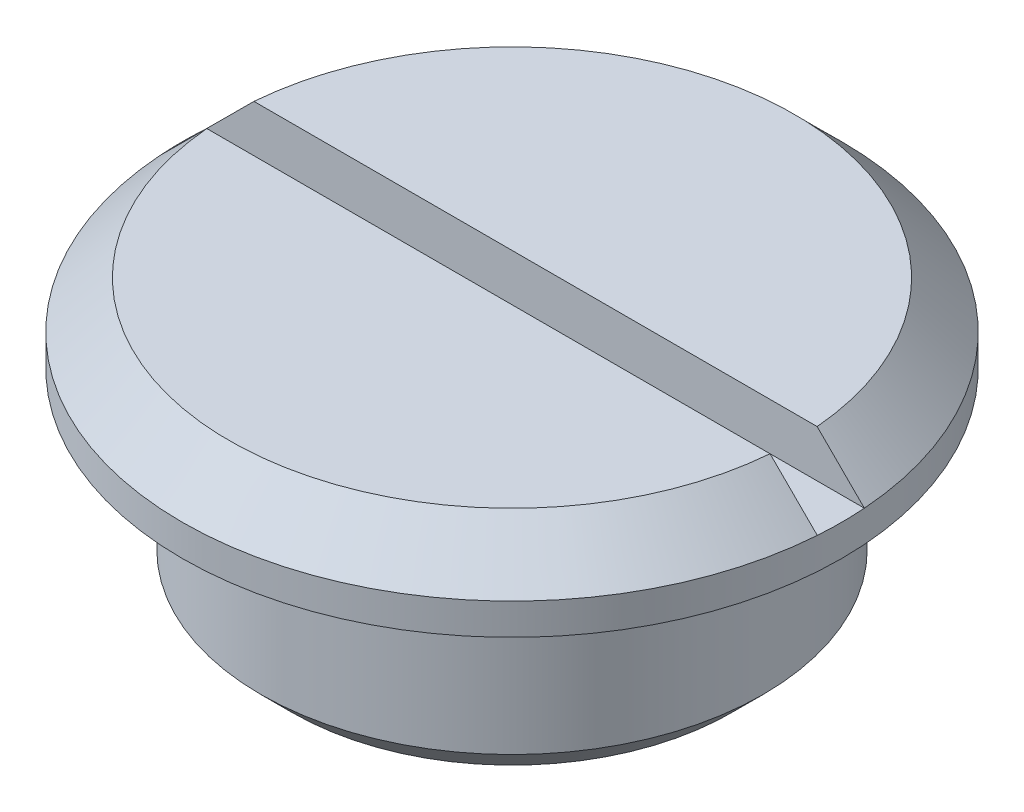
SolidWorks part; units mm, degrees
ref_plane "Plan1" through (0, 0, 0) normal (0, 0, 1) x (1, 0, 0)
ref_plane "Plan2" through (0, 0, 0) normal (0, 1, 0) x (1, 0, 0)
ref_plane "Plan3" through (0, 0, 0) normal (1, 0, 0) x (0, 0, -1)
sketch "Esquisse1" plane through (0, 0, 0) normal (0, 0, 1) x (1, 0, 0)
  line L0 (0, 46) -> (0, -47) construction
  line L1 (0, 0) -> (-7, 0)
  line L2 (-7, 0) -> (-8, 1)
  line L3 (-8, 1) -> (-8, 4.75)
  line L4 (-8, 4.75) -> (-6.75, 4.75)
  line L5 (-6.75, 4.75) -> (-6.75, 6)
  line L6 (-6.75, 6) -> (-10.5, 6)
  line L7 (-10.5, 6) -> (-10.5, 7)
  line L8 (-10.5, 7) -> (-9, 8.5)
  line L9 (-9, 8.5) -> (0, 8.5)
  line L10 (0, 8.5) -> (0, 0)
  dimension "D1" = 16
  dimension "D2" = 13.5
  dimension "D3" = 21
  dimension "D4" = 1.5
  dimension "D5" = 1
  dimension "D6" = 1.25
  dimension "D7" = 4.75
  dimension "D8" = 1
  dimension "D9" = 135
  dimension "D10" = 135
revolve "Base-Révolution" add sketch "Esquisse1" angle 360 about L0
sketch "Esquisse2" plane through (0, 8.5, 0) normal (0, 1, 0) x (-1, 0, 0)
  line L0 (-11, 0) -> (11, 0) construction
  line L1 (0, -11) -> (0, 12) construction
  line L2 (-10.5, -0.75) -> (10.5, -0.75)
  line L3 (-10.5, -0.75) -> (-10.5, 0.75)
  line L4 (-10.5, 0.75) -> (10.5, 0.75)
  line L5 (10.5, -0.75) -> (10.5, 0.75)
  dimension "D1" = 1.5
  dimension "D2" = 21
extrude "Enlèv. mat.-Extru.1" cut sketch "Esquisse2" against normal blind 1.5
